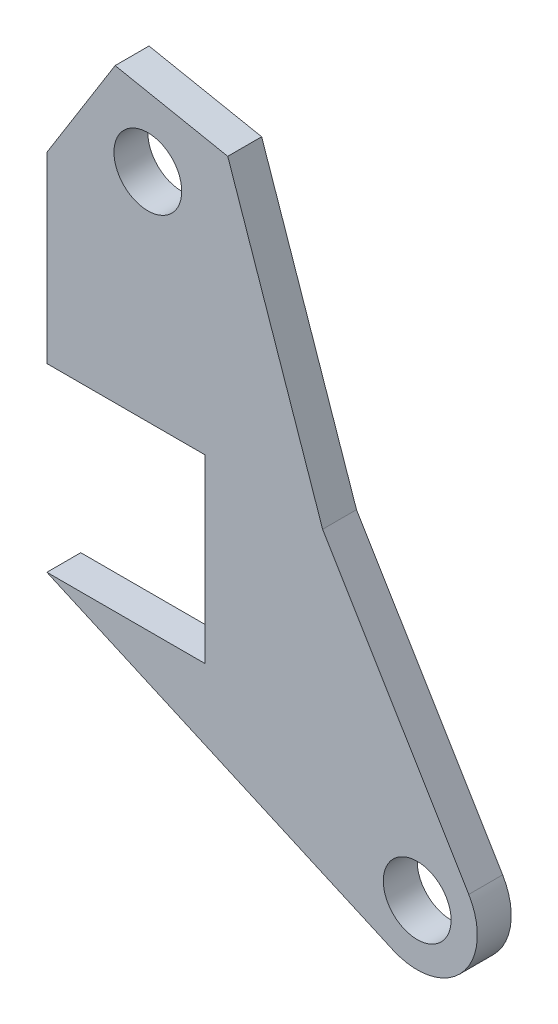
SolidWorks part; units mm, degrees
ref_plane "Plan de face" through (0, 0, 0) normal (0, 0, 1) x (1, 0, 0)
ref_plane "Plan de dessus" through (0, 0, 0) normal (0, 1, 0) x (1, 0, 0)
ref_plane "Plan de droite" through (0, 0, 0) normal (1, 0, 0) x (0, 0, -1)
sketch "Esquisse1" plane through (0, 0, 0) normal (0, 0, 1) x (1, 0, 0)
  line L0 (0, 0) -> (0, 81)
  line L1 (0, 0) -> (70, 0)
  line L2 (70, 0) -> (70, -80)
  line L3 (70, -80) -> (0, -80)
  line L4 (0, -80) -> (153.0874, -148.1589)
  line L5 (186.7314, -110.1313) -> (122.0555, -2.4925)
  line L6 (122.0555, -2.4925) -> (80.0572, 119.4794)
  line L7 (0, 81) -> (30.2054, 129.3387)
  line L8 (30.2054, 129.3387) -> (80.0572, 119.4794)
  circle A0 centre (44.6825, 95.8945) radius 15
  circle A1 centre (163.9144, -123.8412) radius 15
  arc A2 (153.0874, -148.1589) -> (186.7314, -110.1313) centre (163.9144, -123.8412) ccw
  dimension "D14" = 30
  dimension "D17" = 30
  dimension "D1" = 70
  dimension "D2" = 80
  dimension "D3" = 70
  dimension "D4" = 90
  dimension "D5" = 24
  dimension "D7" = 35
  dimension "D9" = 129
  dimension "D10" = 168
  dimension "D11" = 81
  dimension "D12" = 57
  dimension "D13" = 212
  dimension "D15" = 30
  dimension "D16" = 30
  dimension "D18" = 250
extrude "Extrusion1" add sketch "Esquisse1" along normal blind 15
